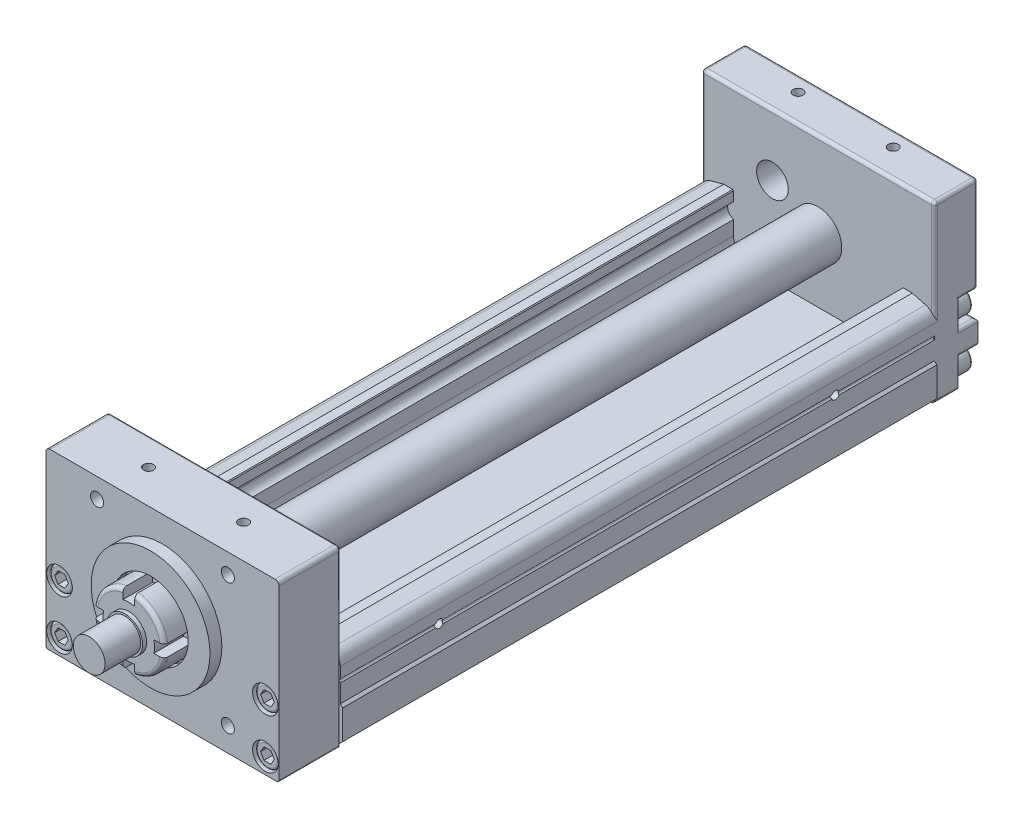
SolidWorks part; units mm, degrees
ref_plane "前视基准面" through (0, 0, 0) normal (0, 0, 1) x (1, 0, 0)
ref_plane "上视基准面" through (0, 0, 0) normal (0, 1, 0) x (1, 0, 0)
ref_plane "右视基准面" through (0, 0, 0) normal (1, 0, 0) x (0, 0, -1)
sketch "Model" plane through (0, 0, 0) normal (0, 0, 1) x (1, 0, 0)
  line L0 (62.3352, 10.2983) -> (62.3352, 2.8983)
  line L1 (2.3352, 2.8983) -> (2.3352, 6.1483)
  line L2 (2.3352, 7.6483) -> (2.3352, 10.2983)
  line L3 (8.5352, 22.8983) -> (10.8352, 22.8983)
  line L4 (53.8352, 22.8983) -> (56.1352, 22.8983)
  line L5 (55.8352, 0.8983) -> (41.8352, 0.8983)
  line L6 (22.8352, 0.8983) -> (8.8352, 0.8983)
  line L7 (2.6852, 7.4483) -> (2.6852, 6.3483)
  line L8 (61.7352, 10.8983) -> (61.7352, 15.4401)
  line L9 (56.3352, 1.3983) -> (60.8352, 1.3983)
  line L10 (23.3352, 1.3983) -> (41.3352, 1.3983)
  line L11 (3.8352, 1.3983) -> (8.3352, 1.3983)
  line L12 (2.9352, 19.0958) -> (2.9352, 16.3566)
  line L13 (53.6352, 16.4617) -> (53.6352, 12.8983)
  line L14 (11.0352, 20.335) -> (11.0352, 22.6983)
  line L15 (2.9352, 15.4401) -> (2.9352, 10.8983)
  line L16 (61.7352, 16.3566) -> (61.7352, 19.0958)
  line L17 (48.6352, 7.8983) -> (16.0352, 7.8983)
  line L18 (8.3352, 1.3983) -> (8.8352, 0.8983)
  line L19 (22.8352, 0.8983) -> (23.3352, 1.3983)
  line L20 (41.3352, 1.3983) -> (41.8352, 0.8983)
  line L21 (55.8352, 0.8983) -> (56.3352, 1.3983)
  line L22 (53.8352, 22.8983) -> (53.6352, 22.6983)
  line L23 (11.0352, 22.6983) -> (10.8352, 22.8983)
  line L24 (2.3352, 7.6483) -> (2.4852, 7.6483)
  line L25 (2.4852, 6.1483) -> (2.3352, 6.1483)
  line L26 (59.5116, 21.9936) -> (56.1352, 22.8983)
  line L27 (62.3352, 10.2983) -> (61.7352, 10.8983)
  line L28 (60.8352, 1.3983) -> (62.3352, 2.8983)
  line L29 (2.3352, 2.8983) -> (3.8352, 1.3983)
  line L30 (2.9352, 10.8983) -> (2.3352, 10.2983)
  line L31 (8.5352, 22.8983) -> (5.1587, 21.9936)
  line L32 (53.6352, 22.6983) -> (53.6352, 20.335)
  line L33 (11.0352, 12.8983) -> (11.0352, 16.4617)
  arc A0 (9.5175, 18.3983) -> (11.0352, 16.4617) centre (11.6194, 18.4825) ccw
  arc A1 (11.0352, 20.335) -> (9.5175, 18.3983) centre (11.6194, 18.3141) ccw
  arc A2 (55.1528, 18.3983) -> (53.6352, 20.335) centre (53.051, 18.3141) ccw
  arc A3 (53.6352, 16.4617) -> (55.1528, 18.3983) centre (53.051, 18.4825) ccw
  arc A4 (2.6852, 7.4483) -> (2.4852, 7.6483) centre (2.4852, 7.4483) ccw
  arc A5 (2.4852, 6.1483) -> (2.6852, 6.3483) centre (2.4852, 6.3483) ccw
  arc A6 (2.9352, 15.4401) -> (2.9352, 16.3566) centre (2.7352, 15.8983) ccw
  arc A7 (61.7352, 19.0958) -> (59.5116, 21.9936) centre (58.7352, 19.0958) ccw
  arc A8 (5.1587, 21.9936) -> (2.9352, 19.0958) centre (5.9352, 19.0958) ccw
  arc A9 (48.6352, 7.8983) -> (53.6352, 12.8983) centre (48.6352, 12.8983) ccw
  arc A10 (11.0352, 12.8983) -> (16.0352, 7.8983) centre (16.0352, 12.8983) ccw
  arc A11 (61.7352, 16.3566) -> (61.7352, 15.4401) centre (61.9352, 15.8983) ccw
extrude "凸台-拉伸1" add sketch "Model" along normal mid plane 150
hole_wizard "打孔尺寸(%根据)内六角圆柱头螺钉的类型1" positions "草图3" profile "草图2" counterbore size "M5" standard "GB"
sketch "草图3" plane through (0, 7.8983, 0) normal (0, 1, 0) x (1, 0, 0)
  line L0 (32.3352, 75) -> (32.3352, -75) construction
  line L1 (48.6352, 75) -> (16.0352, 75) construction
  line L2 (48.6352, -75) -> (16.0352, -75) construction
  point P0 (17.3352, -50)
  point P2 (47.3352, -50)
  dimension "D1" = 30
  dimension "D2" = 25
sketch "草图2" plane through (17.3352, 7.8983, 50) normal (1, 0, 0) x (0, 0, 1)
  line L0 (0, 0) -> (0, 7)
  line L1 (0, 7) -> (2.75, 7)
  line L3 (2.75, 7) -> (2.75, 4.7)
  line L4 (5, 4.7) -> (2.75, 4.7)
  line L5 (5, 4.7) -> (5, 0.025)
  line L6 (5, 0.025) -> (5.025, 0)
  line L7 (5.025, 0) -> (0, 0)
  line L8 (-5, 0.025) -> (-5.025, 0) construction
  line L11 (0, -6.35) -> (0, 107.95) construction
  dimension "通孔孔直径" = 5.5
  dimension "通孔孔深度" = 7
  dimension "柱形沉头孔直径" = 10
  dimension "柱形沉头孔深度" = 4.7
  dimension "近端锥形沉头孔直径" = 10.05
  dimension "近端锥形沉头孔角度" = 90
sketch "草图4" plane through (0, 3.1983, 0) normal (0, 1, 0) x (1, 0, 0)
  circle A0 centre (17.3352, -50) radius 5 construction
  circle A1 centre (47.3352, -50) radius 5 construction
  circle A2 centre (17.3352, -50) radius 5
  circle A3 centre (47.3352, -50) radius 5
extrude "切除-拉伸1" cut sketch "草图4" along normal blind 50
pattern_linear "阵列(线性)1" count 2 spacing 100 along (0, 0, -1) of "切除-拉伸1", "打孔尺寸(%根据)内六角圆柱头螺钉的类型1"
hole_wizard "M2.5 螺纹孔1" positions "草图6" profile "草图5" tap size "M2.5" standard "GB"
sketch "草图6" plane through (61.7352, 0, 0) normal (1, 0, 0) x (0, 0, -1)
  line L0 (-75, 0.8983) -> (75, 0.8983) construction
  point P0 (-50, 15.8983)
  dimension "D1" = 25
  dimension "D2" = 15
sketch "草图5" plane through (61.7352, 15.8983, 50) normal (0, 1, 0) x (0, 0, -1)
  line L0 (0, 0) -> (0, 6.9659)
  line L1 (0, 6.9659) -> (1.025, 6.35)
  line L2 (1.025, 6.35) -> (1.025, 0)
  line L5 (1.025, 0) -> (0, 0)
  line L10 (0, 6.9659) -> (-1.025, 6.35) construction
  line L11 (0, -6.35) -> (0, 107.95) construction
  dimension "螺纹孔钻头直径" = 2.05
  dimension "螺纹孔钻头深度" = 6.35
  dimension "导头角度" = 118
hole_wizard "M2.5 螺纹孔2" positions "草图8" profile "草图7" tap size "M2.5" standard "GB"
sketch "草图8" plane through (2.9352, 0, 0) normal (-1, 0, 0) x (0, 0, 1)
  point P0 (50, 15.8983)
sketch "草图7" plane through (2.9352, 15.8983, 50) normal (0, 1, 0) x (0, 0, 1)
  line L0 (0, 0) -> (0, 6.9659)
  line L1 (0, 6.9659) -> (1.025, 6.35)
  line L2 (1.025, 6.35) -> (1.025, 0)
  line L5 (1.025, 0) -> (0, 0)
  line L10 (0, 6.9659) -> (-1.025, 6.35) construction
  line L11 (0, -6.35) -> (0, 107.95) construction
  dimension "螺纹孔钻头直径" = 2.05
  dimension "螺纹孔钻头深度" = 6.35
  dimension "导头角度" = 118
pattern_linear "阵列(线性)2" count 2 spacing 100 along (0, 0, -1) of "M2.5 螺纹孔2", "M2.5 螺纹孔1"
sketch "草图9" plane through (0, 0, 75) normal (0, 0, 1) x (1, 0, 0)
  line L0 (2.9352, 15.4401) -> (2.9352, 10.8983) construction
  line L1 (2.9352, 1.3983) -> (61.7352, 1.3983)
  line L2 (2.9352, 1.3983) -> (2.9352, 45.3983)
  line L3 (2.9352, 45.3983) -> (61.7352, 45.3983)
  line L4 (61.7352, 1.3983) -> (61.7352, 45.3983)
  line L5 (61.7352, 10.8983) -> (61.7352, 15.4401) construction
  line L6 (3.8352, 1.3983) -> (8.3352, 1.3983) construction
  line L7 (8.8352, 0.8983) -> (22.8352, 0.8983) construction
  dimension "D1" = 44.5
extrude "凸台-拉伸2" add sketch "草图9" along normal blind 59 separate body
sketch "草图11" plane through (2.9352, 0, 0) normal (-1, 0, 0) x (0, 0, 1)
  line L0 (86, 1.3983) -> (86, 26.3983)
  line L2 (86, 26.3983) -> (93.5, 26.3983)
  line L3 (93.5, 26.3983) -> (93.5, 35.3983)
  line L4 (93.5, 35.3983) -> (124, 35.3983)
  line L5 (124, 35.3983) -> (124, 1.3983)
  line L6 (124, 1.3983) -> (86, 1.3983)
  line L7 (75, 45.3983) -> (75, 1.3983) construction
  line L8 (134, 1.3983) -> (75, 1.3983) construction
  dimension "D1" = 11
  dimension "D2" = 38
  dimension "D3" = 7.5
  dimension "D4" = 25
  dimension "D5" = 34
extrude "切除-拉伸2" cut sketch "草图11" against normal blind 10
sketch "草图13" plane through (61.7352, 0, 0) normal (1, 0, 0) x (0, 0, -1)
  line L6 (-124, 1.3983) -> (-86, 1.3983)
  line L7 (-124, 35.3983) -> (-124, 1.3983)
  line L8 (-93.5, 35.3983) -> (-124, 35.3983)
  line L9 (-93.5, 26.3983) -> (-93.5, 35.3983)
  line L10 (-86, 26.3983) -> (-93.5, 26.3983)
  line L11 (-86, 1.3983) -> (-86, 26.3983)
  line L12 (-124, 1.3983) -> (-86, 1.3983)
  line L13 (-124, 35.3983) -> (-124, 1.3983)
  line L14 (-93.5, 35.3983) -> (-124, 35.3983)
  line L15 (-93.5, 26.3983) -> (-93.5, 35.3983)
  line L16 (-86, 26.3983) -> (-93.5, 26.3983)
  line L17 (-86, 1.3983) -> (-86, 26.3983)
  dimension "D1" = 0
extrude "切除-拉伸3" cut sketch "草图13" against normal blind 10
sketch "草图16" plane through (0, 45.3983, 0) normal (0, 1, 0) x (1, 0, 0)
  line L0 (32.3352, -134) -> (32.3352, 75) construction
  line L1 (61.7352, -134) -> (2.9352, -134) construction
  line L2 (48.6352, 75) -> (16.0352, 75) construction
  line L3 (61.7352, -75) -> (2.9352, -75) construction
  line L4 (12.3352, -93.5) -> (52.3352, -93.5)
  line L5 (12.3352, -93.5) -> (12.3352, -124)
  line L6 (12.3352, -124) -> (52.3352, -124)
  line L7 (52.3352, -93.5) -> (52.3352, -124)
  dimension "D1" = 18.5
  dimension "D2" = 10
  dimension "D3" = 40
extrude "切除-拉伸5" cut sketch "草图16" against normal blind 33
sketch "草图14" plane through (0, 0, 134) normal (0, 0, 1) x (1, 0, 0)
  line L0 (32.3352, 1.3983) -> (32.3352, 45.3983) construction
  line L1 (2.9352, 1.3983) -> (61.7352, 1.3983) construction
  line L2 (61.7352, 45.3983) -> (2.9352, 45.3983) construction
  line L3 (8.8352, 0.8983) -> (22.8352, 0.8983) construction
  circle A0 centre (32.3352, 23.8983) radius 14
  dimension "D1" = 28
  dimension "D2" = 23
extrude "切除-拉伸4" cut sketch "草图14" against normal up to surface (40.5 mm away)
fillet "圆角1" radius 3 8 edges at (7.6352, 35.3983, 124) (7.6352, 35.3983, 93.5) (7.9352, 26.3983, 93.5) (7.9352, 26.3983, 86) (57.0352, 35.3983, 124) (56.7352, 26.3983, 86) (56.7352, 26.3983, 93.5) (57.0352, 35.3983, 93.5)
hole_wizard "M3 螺纹孔1" positions "草图18" profile "草图17" tap size "M3" standard "GB"
sketch "草图18" plane through (0, 0, 134) normal (0, 0, 1) x (1, 0, 0)
  line L1 (32.3352, 37.8983) -> (32.3352, 23.8983) construction
  line L2 (32.3352, 23.8983) -> (18.3352, 23.8983) construction
  line L4 (15.0146, 33.8983) -> (49.6557, 13.8983) construction
  line L6 (49.6557, 33.8983) -> (15.0146, 13.8983) construction
  circle A1 centre (32.3352, 23.8983) radius 14 construction
  circle A2 centre (32.3352, 23.8983) radius 20 construction
  point P0 (15.0146, 33.8983)
  point P22 (49.6557, 13.8983)
  point P25 (49.6557, 33.8983)
  point P26 (15.0146, 13.8983)
  dimension "D1" = 40
  dimension "D2" = 30
  dimension "D3" = 30
sketch "草图17" plane through (15.0146, 33.8983, 134) normal (1, 0, 0) x (0, -1, 0)
  line L0 (0, 0) -> (0, 8.2511)
  line L1 (0, 8.2511) -> (1.25, 7.5)
  line L2 (1.25, 7.5) -> (1.25, 0)
  line L5 (1.25, 0) -> (0, 0)
  line L10 (0, 8.2511) -> (-1.25, 7.5) construction
  line L11 (0, -6.35) -> (0, 107.95) construction
  dimension "螺纹孔钻头直径" = 2.5
  dimension "螺纹孔钻头深度" = 7.5
  dimension "导头角度" = 118
hole_wizard "M4 螺纹孔1" positions "草图20" profile "草图19" tap size "M4" standard "GB"
sketch "草图20" plane through (0, 0, 134) normal (0, 0, 1) x (1, 0, 0)
  line L0 (32.3352, 37.8983) -> (32.3352, 23.8983) construction
  line L1 (32.3352, 23.8983) -> (12.3352, 23.8983) construction
  line L3 (18.193, 38.0405) -> (46.4773, 9.7562) construction
  line L5 (46.4773, 38.0405) -> (18.193, 9.7562) construction
  circle A0 centre (32.3352, 23.8983) radius 20 construction
  circle A1 centre (32.3352, 23.8983) radius 14 construction
  point P0 (18.193, 38.0405)
  point P16 (46.4773, 9.7562)
  point P19 (46.4773, 38.0405)
  point P20 (18.193, 9.7562)
  dimension "D1" = 45
  dimension "D3" = 40
  dimension "D2" = 45
sketch "草图19" plane through (18.193, 38.0405, 134) normal (1, 0, 0) x (0, -1, 0)
  line L0 (0, 0) -> (0, 11.0914)
  line L1 (0, 11.0914) -> (1.65, 10.1)
  line L2 (1.65, 10.1) -> (1.65, 0)
  line L5 (1.65, 0) -> (0, 0)
  line L10 (0, 11.0914) -> (-1.65, 10.1) construction
  line L11 (0, -6.35) -> (0, 107.95) construction
  dimension "螺纹孔钻头直径" = 3.3
  dimension "螺纹孔钻头深度" = 10.1
  dimension "导头角度" = 118
fillet "圆角2" radius 1 26 edges at (2.9352, 1.3983, 129) (61.7352, 1.3983, 129) (2.9352, 45.3983, 104.5) (61.7352, 45.3983, 104.5) (52.3352, 45.3983, 108.75) (32.3352, 45.3983, 124) (32.3352, 45.3983, 93.5) (12.3352, 45.3983, 108.75) (2.9352, 16.8983, 124) (2.9352, 34.5196, 123.1213) (2.9352, 12.3983, 86) (2.9352, 25.5196, 86.8787) (2.9352, 26.3983, 89.75) (2.9352, 27.277, 92.6213) (2.9352, 30.8983, 93.5) (2.9352, 34.5196, 94.3787) (61.7352, 12.3983, 86) (61.7352, 25.5196, 86.8787) (61.7352, 26.3983, 89.75) (61.7352, 27.277, 92.6213) (61.7352, 30.8983, 93.5) (61.7352, 34.5196, 94.3787) (61.7352, 35.3983, 108.75) (61.7352, 34.5196, 123.1213) (2.9352, 35.3983, 108.75) (61.7352, 16.8983, 124)
fillet "圆角3" radius 0.5 13 edges at (61.4423, 45.1054, 75) (61.7352, 22.8983, 75) (2.9352, 22.8983, 75) (3.228, 45.1054, 75) (3.228, 45.1054, 134) (32.3352, 45.3983, 134) (61.4423, 45.1054, 134) (61.7352, 23.3983, 134) (61.4423, 1.6912, 134) (32.3352, 1.3983, 134) (3.228, 1.6912, 134) (32.3352, 45.3983, 75) (2.9352, 23.3983, 134)
sketch "草图26" plane through (0, 0, 134) normal (0, 0, 1) x (1, 0, 0)
  line L0 (32.3352, 23.8983) -> (32.3352, 9.8983) construction
  line L1 (3.8352, 1.3983) -> (8.3352, 1.3983) construction
  circle A0 centre (6.3352, 17.8983) radius 1.75
  circle A1 centre (6.3352, 5.3983) radius 1.75
  circle A2 centre (58.3352, 5.3983) radius 1.75
  circle A3 centre (58.3352, 17.8983) radius 1.75
  arc A4 (24.3508, 12.3983) -> (40.3195, 12.3983) centre (32.3352, 23.8983) ccw construction
  dimension "D1" = 4
  dimension "D2" = 12.5
  dimension "D3" = 52
  dimension "D4" = 3.5
extrude "切除-拉伸7" cut sketch "草图26" against normal blind 20
sketch "草图21" plane through (0, 0, 93.5) normal (0, 0, 1) x (1, 0, 0)
  circle A0 centre (32.3352, 23.8983) radius 9.5
  dimension "D1" = 19
extrude "切除-拉伸6" cut sketch "草图21" against normal blind 2
sketch "草图22" plane through (0, 0, 91.5) normal (0, 0, 1) x (1, 0, 0)
  line L0 (32.3352, 33.3983) -> (32.3352, 14.3983) construction
  line L1 (22.8352, 23.8983) -> (41.8352, 23.8983) construction
  line L2 (30.8352, 32.7724) -> (30.8352, 30.2229)
  line L3 (23.461, 22.3983) -> (26.0106, 22.3983)
  line L4 (33.8352, 32.7724) -> (33.8352, 30.2229)
  line L5 (23.461, 25.3983) -> (26.0106, 25.3983)
  line L6 (30.8352, 25.3983) -> (30.8352, 22.3983) construction
  line L7 (30.8352, 33.3983) -> (30.8352, 14.3983) construction
  line L8 (33.8352, 33.3983) -> (33.8352, 14.3983) construction
  line L9 (33.8352, 25.3983) -> (33.8352, 22.3983) construction
  line L10 (38.6597, 25.3983) -> (41.2093, 25.3983)
  line L11 (22.8352, 25.3983) -> (41.8352, 25.3983) construction
  line L12 (22.8352, 22.3983) -> (41.8352, 22.3983) construction
  line L13 (38.6597, 22.3983) -> (41.2093, 22.3983)
  line L14 (30.8352, 25.3983) -> (33.8352, 25.3983) construction
  line L15 (30.8352, 22.3983) -> (33.8352, 22.3983) construction
  line L16 (30.8352, 17.5738) -> (30.8352, 15.0242)
  line L17 (33.8352, 17.5738) -> (33.8352, 15.0242)
  arc A0 (30.8352, 32.7724) -> (23.461, 25.3983) centre (32.3352, 23.8983) ccw
  circle A1 centre (32.3352, 23.8983) radius 9.5 construction
  circle A2 centre (32.3352, 23.8983) radius 9.5 construction
  arc A3 (26.0106, 25.3983) -> (26.0106, 22.3983) centre (32.3352, 23.8983) ccw
  arc A4 (33.8352, 30.2229) -> (30.8352, 30.2229) centre (32.3352, 23.8983) ccw
  arc A5 (41.2093, 25.3983) -> (33.8352, 32.7724) centre (32.3352, 23.8983) ccw
  arc A6 (38.6597, 22.3983) -> (38.6597, 25.3983) centre (32.3352, 23.8983) ccw
  arc A7 (33.8352, 15.0242) -> (41.2093, 22.3983) centre (32.3352, 23.8983) ccw
  arc A8 (30.8352, 17.5738) -> (33.8352, 17.5738) centre (32.3352, 23.8983) ccw
  arc A9 (23.461, 22.3983) -> (30.8352, 15.0242) centre (32.3352, 23.8983) ccw
  dimension "D1" = 18
  dimension "D2" = 13
  dimension "D3" = 1.5
  dimension "D4" = 1.5
extrude "凸台-拉伸3" add sketch "草图22" along normal blind 7.5
fillet "圆角4" radius 1 4 edges at (38.6991, 17.5344, 99) (25.9712, 17.5344, 99) (38.6991, 30.2623, 99) (25.9712, 30.2623, 99)
sketch "草图23" plane through (0, 0, 99) normal (0, 0, 1) x (1, 0, 0)
  circle A0 centre (32.3352, 23.8983) radius 4.5
  dimension "D1" = 9
extrude "凸台-拉伸4" add sketch "草图23" along normal blind 1
sketch "草图24" plane through (0, 0, 100) normal (0, 0, 1) x (1, 0, 0)
  circle A0 centre (32.3352, 23.8983) radius 4
  dimension "D1" = 8
extrude "凸台-拉伸5" add sketch "草图24" along normal blind 9
sketch "草图27" plane through (0, 0, -75) normal (0, 0, -1) x (-1, 0, 0)
  line L0 (-61.7352, 1.3983) -> (-61.7352, 44.3983) construction
  line L1 (-61.7352, 45.3983) -> (-2.9352, 45.3983)
  line L2 (-61.7352, 45.3983) -> (-61.7352, 1.3983)
  line L3 (-61.7352, 1.3983) -> (-2.9352, 1.3983)
  line L4 (-2.9352, 45.3983) -> (-2.9352, 1.3983)
  line L5 (-23.3352, 1.3983) -> (-41.3352, 1.3983) construction
  line L6 (-2.9352, 15.4401) -> (-2.9352, 10.8983) construction
  line L7 (-60.7352, 45.3983) -> (-3.9352, 45.3983) construction
extrude "凸台-拉伸6" add sketch "草图27" along normal blind 11 separate body
sketch "草图28" plane through (0, 0, -86) normal (0, 0, -1) x (-1, 0, 0)
  circle A0 centre (-32.3352, 23.8983) radius 6.5
  dimension "D1" = 13
extrude "切除-拉伸8" cut sketch "草图28" against normal blind 4.5
sketch "草图29" plane through (0, 0, -81.5) normal (0, 0, -1) x (-1, 0, 0)
  circle A0 centre (-32.3352, 23.8983) radius 3
  dimension "D1" = 6
extrude "凸台-拉伸7" add sketch "草图29" along normal blind 2.5 separate body
sketch "草图30" plane through (0, 0, -81.5) normal (0, 0, -1) x (-1, 0, 0)
  circle A0 centre (-32.3352, 23.8983) radius 4
  circle A1 centre (-32.3352, 23.8983) radius 5.25
  dimension "D1" = 8
  dimension "D2" = 10.5
extrude "切除-拉伸9" cut sketch "草图30" against normal blind 0.2
fillet "圆角5" radius 0.2 3 edges at (25.8352, 23.8983, -81.5) (27.0852, 23.8983, -81.5) (28.3352, 23.8983, -81.5)
sketch "草图31" plane through (0, 0, 75) normal (0, 0, -1) x (-1, 0, 0)
  circle A0 centre (-32.3352, 23.8983) radius 6
  dimension "D1" = 12
extrude "凸台-拉伸8" add sketch "草图31" along normal up to surface (150 mm away)
sketch "草图32" plane through (0, 0, -86) normal (0, 0, -1) x (-1, 0, 0)
  line L0 (-58.3352, 21.1483) -> (-61.7352, 21.1483)
  line L1 (-61.7352, 45.3983) -> (-61.7352, 1.3983) construction
  line L2 (-61.7352, 21.1483) -> (-61.7352, 14.6483)
  line L3 (-61.7352, 14.6483) -> (-58.3352, 14.6483)
  line L4 (-58.3352, 8.6483) -> (-61.7352, 8.6483)
  line L5 (-61.7352, 8.6483) -> (-61.7352, 1.3983)
  line L6 (-61.7352, 1.3983) -> (-55.0852, 1.3983)
  line L7 (-61.7352, 1.3983) -> (-2.9352, 1.3983) construction
  line L8 (-55.0852, 1.3983) -> (-55.0852, 5.3983)
  line L9 (-6.3352, 21.1483) -> (-2.9352, 21.1483)
  line L10 (-2.9352, 1.3983) -> (-2.9352, 45.3983) construction
  line L11 (-2.9352, 21.1483) -> (-2.9352, 14.6483)
  line L12 (-2.9352, 14.6483) -> (-6.3352, 14.6483)
  line L13 (-6.3352, 8.6483) -> (-2.9352, 8.6483)
  line L14 (-2.9352, 8.6483) -> (-2.9352, 1.3983)
  line L15 (-2.9352, 1.3983) -> (-9.5852, 1.3983)
  line L16 (-9.5852, 1.3983) -> (-9.5852, 5.3983)
  arc A0 (-58.3352, 14.6483) -> (-58.3352, 21.1483) centre (-58.3352, 17.8983) ccw
  arc A1 (-55.0852, 5.3983) -> (-58.3352, 8.6483) centre (-58.3352, 5.3983) ccw
  arc A2 (-6.3352, 21.1483) -> (-6.3352, 14.6483) centre (-6.3352, 17.8983) ccw
  arc A3 (-6.3352, 8.6483) -> (-9.5852, 5.3983) centre (-6.3352, 5.3983) ccw
  dimension "D1" = 6.5
extrude "切除-拉伸10" cut sketch "草图32" against normal blind 5
sketch "草图33" plane through (0, 0, -81) normal (0, 0, -1) x (-1, 0, 0)
  circle A0 centre (-58.3352, 17.8983) radius 3
  circle A1 centre (-58.3352, 5.3983) radius 3
  circle A2 centre (-6.3352, 5.3983) radius 3
  circle A3 centre (-6.3352, 17.8983) radius 3
  dimension "D1" = 6
extrude "凸台-拉伸9" add sketch "草图33" along normal blind 4
sketch "草图34" plane through (0, 0, -85) normal (0, 0, -1) x (-1, 0, 0)
  line L1 (-59.2012, 19.3983) -> (-60.0672, 17.8983)
  line L2 (-60.0672, 17.8983) -> (-59.2012, 16.3983)
  line L3 (-59.2012, 16.3983) -> (-57.4691, 16.3983)
  line L4 (-57.4691, 16.3983) -> (-56.6031, 17.8983)
  line L5 (-56.6031, 17.8983) -> (-57.4691, 19.3983)
  line L6 (-57.4691, 19.3983) -> (-59.2012, 19.3983)
  line L7 (-59.2012, 6.8983) -> (-60.0672, 5.3983)
  line L8 (-60.0672, 5.3983) -> (-59.2012, 3.8983)
  line L9 (-59.2012, 3.8983) -> (-57.4691, 3.8983)
  line L10 (-57.4691, 3.8983) -> (-56.6031, 5.3983)
  line L11 (-56.6031, 5.3983) -> (-57.4691, 6.8983)
  line L12 (-57.4691, 6.8983) -> (-59.2012, 6.8983)
  line L13 (-5.4691, 6.8983) -> (-7.2012, 6.8983)
  line L14 (-7.2012, 6.8983) -> (-8.0672, 5.3983)
  line L15 (-8.0672, 5.3983) -> (-7.2012, 3.8983)
  line L16 (-7.2012, 3.8983) -> (-5.4691, 3.8983)
  line L17 (-5.4691, 3.8983) -> (-4.6031, 5.3983)
  line L18 (-4.6031, 5.3983) -> (-5.4691, 6.8983)
  line L19 (-5.4691, 19.3983) -> (-7.2012, 19.3983)
  line L20 (-7.2012, 19.3983) -> (-8.0672, 17.8983)
  line L21 (-8.0672, 17.8983) -> (-7.2012, 16.3983)
  line L22 (-7.2012, 16.3983) -> (-5.4691, 16.3983)
  line L23 (-5.4691, 16.3983) -> (-4.6031, 17.8983)
  line L24 (-4.6031, 17.8983) -> (-5.4691, 19.3983)
  circle A0 centre (-58.3352, 17.8983) radius 1.5 construction
  circle A1 centre (-58.3352, 5.3983) radius 1.5 construction
  circle A2 centre (-6.3352, 5.3983) radius 1.5 construction
  circle A3 centre (-6.3352, 17.8983) radius 1.5 construction
  dimension "D1" = 3
extrude "切除-拉伸11" cut sketch "草图34" against normal blind 3
hole_wizard "M3 螺纹孔2" positions "草图36" profile "草图35" tap size "M3" standard "GB"
sketch "草图36" plane through (0, 45.3983, 0) normal (0, 1, 0) x (1, 0, 0)
  line L0 (32.3352, 86) -> (32.3352, -142.3322) construction
  line L1 (2.9352, 86) -> (61.7352, 86) construction
  line L3 (48.6352, -75) -> (16.0352, -75) construction
  point P0 (20.3352, -82)
  point P2 (44.3352, -82)
  point P4 (20.3352, 82)
  point P6 (44.3352, 82)
  dimension "D1" = 24
  dimension "D2" = 4
  dimension "D3" = 7
sketch "草图35" plane through (20.3352, 45.3983, 82) normal (1, 0, 0) x (0, 0, 1)
  line L0 (0, 0) -> (0, 8.2511)
  line L1 (0, 8.2511) -> (1.25, 7.5)
  line L2 (1.25, 7.5) -> (1.25, 0)
  line L5 (1.25, 0) -> (0, 0)
  line L10 (0, 8.2511) -> (-1.25, 7.5) construction
  line L11 (0, -6.35) -> (0, 107.95) construction
  dimension "螺纹孔钻头直径" = 2.5
  dimension "螺纹孔钻头深度" = 7.5
  dimension "导头角度" = 118
fillet "圆角6" radius 0.8 28 edges at (2.9352, 33.2733, -86) (61.7352, 33.2733, -86) (2.9352, 32.2471, -75) (61.7352, 32.2471, -75) (61.7352, 14.6483, -83.5) (60.0352, 14.6483, -86) (55.0852, 17.8983, -86) (60.0352, 21.1483, -86) (61.7352, 21.1483, -83.5) (55.0852, 1.3983, -83.5) (61.7352, 8.6483, -83.5) (60.0352, 8.6483, -86) (56.0371, 7.6964, -86) (55.0852, 3.3983, -86) (2.9352, 8.6483, -83.5) (2.9352, 14.6483, -83.5) (9.5852, 3.3983, -86) (8.6333, 7.6964, -86) (4.6352, 8.6483, -86) (4.6352, 21.1483, -86) (4.6352, 14.6483, -86) (9.5852, 17.8983, -86) (32.3352, 45.3983, -75) (32.3352, 45.3983, -86) (9.5852, 1.3983, -83.5) (61.7352, 1.3983, -78) (2.9352, 45.3983, -80.5) (61.7352, 45.3983, -80.5)
fillet "圆角7" radius 0.5 4 edges at (3.3352, 5.3983, -85) (3.3352, 17.8983, -85) (55.3352, 5.3983, -85) (55.3352, 17.8983, -85)
sketch "草图37" plane through (0, 0, 86) normal (0, 0, 1) x (1, 0, 0)
  circle A0 centre (58.3352, 17.8983) radius 3 construction
  circle A1 centre (58.3352, 5.3983) radius 3 construction
  circle A2 centre (58.3352, 17.8983) radius 3
  circle A3 centre (58.3352, 5.3983) radius 3
  circle A4 centre (6.3352, 5.3983) radius 3 construction
  circle A5 centre (6.3352, 17.8983) radius 3 construction
  circle A6 centre (6.3352, 5.3983) radius 3
  circle A7 centre (6.3352, 17.8983) radius 3
extrude "凸台-拉伸10" add sketch "草图37" along normal blind 4
sketch "草图38" plane through (0, 0, 90) normal (0, 0, 1) x (1, 0, 0)
  line L0 (57.4691, 19.3983) -> (59.2012, 19.3983) construction
  line L1 (59.2012, 19.3983) -> (60.0672, 17.8983) construction
  line L2 (60.0672, 17.8983) -> (59.2012, 16.3983) construction
  line L3 (59.2012, 16.3983) -> (57.4691, 16.3983) construction
  line L4 (57.4691, 16.3983) -> (56.6031, 17.8983) construction
  line L5 (56.6031, 17.8983) -> (57.4691, 19.3983) construction
  line L6 (57.4691, 6.8983) -> (59.2012, 6.8983) construction
  line L7 (59.2012, 6.8983) -> (60.0672, 5.3983) construction
  line L8 (60.0672, 5.3983) -> (59.2012, 3.8983) construction
  line L9 (59.2012, 3.8983) -> (57.4691, 3.8983) construction
  line L10 (57.4691, 3.8983) -> (56.6031, 5.3983) construction
  line L11 (56.6031, 5.3983) -> (57.4691, 6.8983) construction
  line L12 (4.6031, 5.3983) -> (5.4691, 6.8983) construction
  line L13 (5.4691, 6.8983) -> (7.2012, 6.8983) construction
  line L14 (7.2012, 6.8983) -> (8.0672, 5.3983) construction
  line L15 (8.0672, 5.3983) -> (7.2012, 3.8983) construction
  line L16 (7.2012, 3.8983) -> (5.4691, 3.8983) construction
  line L17 (5.4691, 3.8983) -> (4.6031, 5.3983) construction
  line L18 (4.6031, 17.8983) -> (5.4691, 19.3983) construction
  line L19 (5.4691, 19.3983) -> (7.2012, 19.3983) construction
  line L20 (7.2012, 19.3983) -> (8.0672, 17.8983) construction
  line L21 (8.0672, 17.8983) -> (7.2012, 16.3983) construction
  line L22 (7.2012, 16.3983) -> (5.4691, 16.3983) construction
  line L23 (5.4691, 16.3983) -> (4.6031, 17.8983) construction
  line L24 (57.4691, 19.3983) -> (59.2012, 19.3983)
  line L25 (59.2012, 19.3983) -> (60.0672, 17.8983)
  line L26 (60.0672, 17.8983) -> (59.2012, 16.3983)
  line L27 (59.2012, 16.3983) -> (57.4691, 16.3983)
  line L28 (57.4691, 16.3983) -> (56.6031, 17.8983)
  line L29 (56.6031, 17.8983) -> (57.4691, 19.3983)
  line L30 (57.4691, 6.8983) -> (59.2012, 6.8983)
  line L31 (59.2012, 6.8983) -> (60.0672, 5.3983)
  line L32 (60.0672, 5.3983) -> (59.2012, 3.8983)
  line L33 (59.2012, 3.8983) -> (57.4691, 3.8983)
  line L34 (57.4691, 3.8983) -> (56.6031, 5.3983)
  line L35 (56.6031, 5.3983) -> (57.4691, 6.8983)
  line L36 (4.6031, 5.3983) -> (5.4691, 6.8983)
  line L37 (5.4691, 6.8983) -> (7.2012, 6.8983)
  line L38 (7.2012, 6.8983) -> (8.0672, 5.3983)
  line L39 (8.0672, 5.3983) -> (7.2012, 3.8983)
  line L40 (7.2012, 3.8983) -> (5.4691, 3.8983)
  line L41 (5.4691, 3.8983) -> (4.6031, 5.3983)
  line L42 (4.6031, 17.8983) -> (5.4691, 19.3983)
  line L43 (5.4691, 19.3983) -> (7.2012, 19.3983)
  line L44 (7.2012, 19.3983) -> (8.0672, 17.8983)
  line L45 (8.0672, 17.8983) -> (7.2012, 16.3983)
  line L46 (7.2012, 16.3983) -> (5.4691, 16.3983)
  line L47 (5.4691, 16.3983) -> (4.6031, 17.8983)
extrude "切除-拉伸12" cut sketch "草图38" against normal blind 3
fillet "圆角8" radius 0.5 4 edges at (9.3352, 17.8983, 90) (9.3352, 5.3983, 90) (61.3352, 5.3983, 90) (61.3352, 17.8983, 90)
sketch "草图39" plane through (0, 0, 75) normal (0, 0, -1) x (-1, 0, 0)
  line L0 (-50.3352, 23.8983) -> (-14.3352, 23.8983) construction
  line L1 (-45.7516, 11.8983) -> (-18.9187, 11.8983)
  line L2 (-45.7516, 35.8983) -> (-18.9187, 35.8983)
  line L4 (-50.3352, 35.8983) -> (-14.3352, 35.8983) construction
  line L5 (-50.3352, 11.8983) -> (-14.3352, 11.8983) construction
  arc A0 (-45.7516, 35.8983) -> (-45.7516, 11.8983) centre (-32.3352, 23.8983) ccw
  arc A1 (-18.9187, 11.8983) -> (-18.9187, 35.8983) centre (-32.3352, 23.8983) ccw
  circle A2 centre (-32.3352, 23.8983) radius 8.5
  dimension "D1" = 36
  dimension "D4" = 17
  dimension "D2" = 12
  dimension "D3" = 12
extrude "凸台-拉伸11" add sketch "草图39" along normal blind 3
sketch "草图40" plane through (0, 0, 72) normal (0, 0, -1) x (-1, 0, 0)
  line L0 (-32.3352, 38.8983) -> (-32.3352, 23.8983) construction
  line L1 (-32.3352, 23.8983) -> (-47.3352, 23.8983) construction
  line L2 (-45.3255, 31.3983) -> (-19.3448, 16.3983) construction
  line L3 (-19.3448, 31.3983) -> (-45.3255, 16.3983) construction
  circle A0 centre (-32.3352, 23.8983) radius 15 construction
  circle A1 centre (-45.3255, 31.3983) radius 3
  circle A2 centre (-45.3255, 16.3983) radius 3
  circle A3 centre (-19.3448, 16.3983) radius 3
  circle A4 centre (-19.3448, 31.3983) radius 3
  dimension "D1" = 30
  dimension "D3" = 30
  dimension "D4" = 6
  dimension "D2" = 30
extrude "凸台-拉伸12" add sketch "草图40" along normal blind 4
sketch "草图41" plane through (0, 0, 68) normal (0, 0, -1) x (-1, 0, 0)
  line L1 (-46.1916, 32.8983) -> (-47.0576, 31.3983)
  line L2 (-47.0576, 31.3983) -> (-46.1916, 29.8983)
  line L3 (-46.1916, 29.8983) -> (-44.4595, 29.8983)
  line L4 (-44.4595, 29.8983) -> (-43.5935, 31.3983)
  line L5 (-43.5935, 31.3983) -> (-44.4595, 32.8983)
  line L6 (-44.4595, 32.8983) -> (-46.1916, 32.8983)
  line L7 (-20.2108, 32.8983) -> (-21.0768, 31.3983)
  line L8 (-21.0768, 31.3983) -> (-20.2108, 29.8983)
  line L9 (-20.2108, 29.8983) -> (-18.4787, 29.8983)
  line L10 (-18.4787, 29.8983) -> (-17.6127, 31.3983)
  line L11 (-17.6127, 31.3983) -> (-18.4787, 32.8983)
  line L12 (-18.4787, 32.8983) -> (-20.2108, 32.8983)
  line L13 (-20.2108, 17.8983) -> (-21.0768, 16.3983)
  line L14 (-21.0768, 16.3983) -> (-20.2108, 14.8983)
  line L15 (-20.2108, 14.8983) -> (-18.4787, 14.8983)
  line L16 (-18.4787, 14.8983) -> (-17.6127, 16.3983)
  line L17 (-17.6127, 16.3983) -> (-18.4787, 17.8983)
  line L18 (-18.4787, 17.8983) -> (-20.2108, 17.8983)
  line L19 (-46.1916, 17.8983) -> (-47.0576, 16.3983)
  line L20 (-47.0576, 16.3983) -> (-46.1916, 14.8983)
  line L21 (-46.1916, 14.8983) -> (-44.4595, 14.8983)
  line L22 (-44.4595, 14.8983) -> (-43.5935, 16.3983)
  line L23 (-43.5935, 16.3983) -> (-44.4595, 17.8983)
  line L24 (-44.4595, 17.8983) -> (-46.1916, 17.8983)
  circle A0 centre (-45.3255, 31.3983) radius 1.5 construction
  circle A1 centre (-19.3448, 31.3983) radius 1.5 construction
  circle A2 centre (-19.3448, 16.3983) radius 1.5 construction
  circle A3 centre (-45.3255, 16.3983) radius 1.5 construction
  dimension "D1" = 3
extrude "切除-拉伸13" cut sketch "草图41" against normal blind 3
fillet "圆角9" radius 0.5 4 edges at (16.3448, 16.3983, 68) (16.3448, 31.3983, 68) (42.3255, 16.3983, 68) (42.3255, 31.3983, 68)
sketch "草图42" plane through (0, 0, -75) normal (0, 0, 1) x (1, 0, 0)
  circle A0 centre (20.8352, 29.8983) radius 4
  circle A1 centre (32.3352, 23.8983) radius 6 construction
  dimension "D1" = 6
  dimension "D2" = 11.5
  dimension "D3" = 8
extrude "切除-拉伸14" cut sketch "草图42" against normal blind 8
sketch "草图43" plane through (0, 0, 134) normal (0, 0, 1) x (1, 0, 0)
  line L1 (-3.3569, 48.1977) -> (65.3666, 48.1977)
  line L2 (-3.3569, 48.1977) -> (-3.3569, -0.7978)
  line L3 (-3.3569, -0.7978) -> (65.3666, -0.7978)
  line L4 (65.3666, 48.1977) -> (65.3666, -0.7978)
  circle A0 centre (32.3352, 23.8983) radius 14 construction
  circle A1 centre (32.3352, 23.8983) radius 14
extrude "切除-拉伸15" cut sketch "草图43" against normal up to surface (40.5 mm away)
sketch "草图44" plane through (0, 0, 93.5) normal (0, 0, 1) x (1, 0, 0)
  line L1 (0.4719, 46.3157) -> (66.8591, 46.3157)
  line L2 (0.4719, 46.3157) -> (0.4719, -1.1872)
  line L3 (0.4719, -1.1872) -> (66.8591, -1.1872)
  line L4 (66.8591, 46.3157) -> (66.8591, -1.1872)
  circle A0 centre (32.3352, 23.8983) radius 15
  dimension "D1" = 30
extrude "切除-拉伸16" cut sketch "草图44" against normal blind 3
sketch "草图45" plane through (0, 0, 90.5) normal (0, 0, 1) x (1, 0, 0)
  line L0 (2.9352, 44.3983) -> (2.9352, 27.3983) construction
  line L1 (2.9352, 28.924) -> (16.3711, 28.924)
  line L2 (2.9352, 28.924) -> (2.9352, 1.3983)
  line L3 (2.9352, 1.3983) -> (16.3711, 1.3983)
  line L4 (16.3711, 28.924) -> (16.3711, 1.3983)
  line L5 (23.3352, 1.3983) -> (8.3352, 1.3983) construction
  line L6 (61.7352, 27.3983) -> (61.7352, 44.3983) construction
  line L7 (61.7352, 30.5463) -> (49.4025, 30.5463)
  line L8 (61.7352, 30.5463) -> (61.7352, 1.3983)
  line L9 (61.7352, 1.3983) -> (49.4025, 1.3983)
  line L10 (49.4025, 30.5463) -> (49.4025, 1.3983)
  line L11 (12.9352, 1.3983) -> (51.7352, 1.3983) construction
  circle A0 centre (6.3352, 17.8983) radius 3.25
  circle A1 centre (6.3352, 5.3983) radius 3.25
  circle A2 centre (58.3352, 5.3983) radius 3.25
  circle A3 centre (58.3352, 17.8983) radius 3.25
  dimension "D1" = 6.5
extrude "凸台-拉伸13" add sketch "草图45" against normal blind 8
hole_wizard "M4 螺纹孔2" positions "草图47" profile "草图48" tap size "M4" standard "GB"
sketch "草图47" plane through (0, 0, 90.5) normal (0, 0, 1) x (1, 0, 0)
  line L0 (32.3352, 23.8983) -> (32.3352, 38.8983) construction
  line L2 (32.3352, 23.8983) -> (10.6912, 23.8983) construction
  circle A0 centre (32.3352, 23.8983) radius 15 construction
  point P0 (15.8352, 40.3983)
  point P2 (48.8352, 40.3983)
  point P4 (48.8352, 7.3983)
  point P6 (15.8352, 7.3983)
  dimension "D1" = 33
  dimension "D2" = 33
sketch "草图48" plane through (15.8352, 40.3983, 90.5) normal (1, 0, 0) x (0, -1, 0)
  line L0 (0, 0) -> (0, 11.0914)
  line L1 (0, 11.0914) -> (1.65, 10.1)
  line L2 (1.65, 10.1) -> (1.65, 0)
  line L5 (1.65, 0) -> (0, 0)
  line L10 (0, 11.0914) -> (-1.65, 10.1) construction
  line L11 (0, -6.35) -> (0, 107.95) construction
  dimension "螺纹孔钻头直径" = 3.3
  dimension "螺纹孔钻头深度" = 10.1
  dimension "导头角度" = 118
fillet "圆角11" radius 0.5 2 edges at (2.9352, 1.3983, 83) (61.7352, 1.3983, 83)
